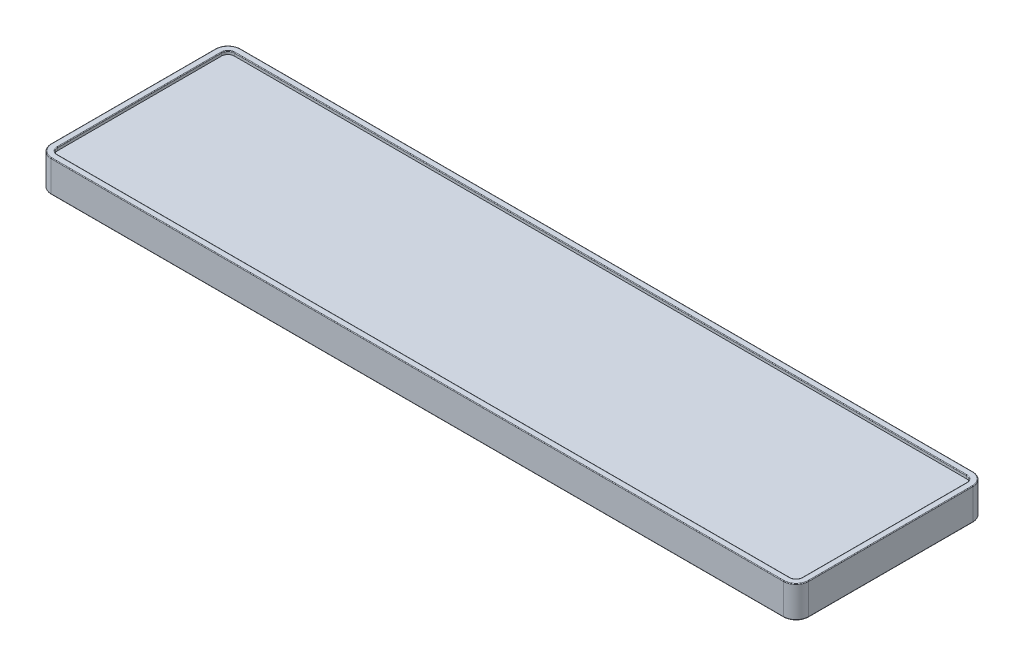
SolidWorks part; units mm, degrees
ref_plane "Alzado" through (0, 0, 0) normal (0, 0, 1) x (1, 0, 0)
ref_plane "Planta" through (0, 0, 0) normal (0, 1, 0) x (1, 0, 0)
ref_plane "Vista lateral" through (0, 0, 0) normal (1, 0, 0) x (0, 0, -1)
sketch "Croquis1" plane through (0, 0, 0) normal (0, 1, 0) x (1, 0, 0)
  line L1 (-580, -150) -> (580, -150)
  line L2 (-600, -130) -> (-600, 130)
  line L3 (-580, 150) -> (580, 150)
  line L4 (600, -130) -> (600, 130)
  line L5 (-600, -150) -> (600, 150) construction
  line L6 (-600, 150) -> (600, -150) construction
  arc A0 (-580, -150) -> (-600, -130) centre (-580, -130) cw
  arc A1 (580, -150) -> (600, -130) centre (580, -130) ccw
  arc A2 (580, 150) -> (600, 130) centre (580, 130) cw
  arc A3 (-600, 130) -> (-580, 150) centre (-580, 130) cw
  point P0 (0, 0)
  dimension "D3" = 20
  dimension "D1" = 300
  dimension "D2" = 1200
extrude "Saliente-Extruir1" add sketch "Croquis1" along normal blind 50
sketch "Croquis2" plane through (0, 50, 0) normal (0, 1, 0) x (1, 0, 0)
  line L8 (-580, -140) -> (580, -140)
  line L9 (590, -130) -> (590, 130)
  line L10 (580, 140) -> (-580, 140)
  line L11 (-590, 130) -> (-590, -130)
  line L12 (-580, -140) -> (580, -140)
  line L13 (590, -130) -> (590, 130)
  line L14 (580, 140) -> (-580, 140)
  line L15 (-590, 130) -> (-590, -130)
  arc A8 (-590, -130) -> (-580, -140) centre (-580, -130) ccw
  arc A9 (580, -140) -> (590, -130) centre (580, -130) ccw
  arc A10 (590, 130) -> (580, 140) centre (580, 130) ccw
  arc A11 (-580, 140) -> (-590, 130) centre (-580, 130) ccw
  arc A12 (-590, -130) -> (-580, -140) centre (-580, -130) ccw
  arc A13 (580, -140) -> (590, -130) centre (580, -130) ccw
  arc A14 (590, 130) -> (580, 140) centre (580, 130) ccw
  arc A15 (-580, 140) -> (-590, 130) centre (-580, 130) ccw
  dimension "D1" = 10
extrude "Cortar-Extruir1" cut sketch "Croquis2" against normal blind 5
shell "Vaciado1" thickness 10
fillet "Redondeo1" radius 1 16 edges at (-600, 50, 0) (-594.1421, 50, -144.1421) (0, 50, -150) (594.1421, 50, -144.1421) (600, 50, 0) (594.1421, 50, 144.1421) (0, 50, 150) (-594.1421, 50, 144.1421) (587.0711, 50, 137.0711) (590, 50, 0) (587.0711, 50, -137.0711) (0, 50, -140) (-587.0711, 50, -137.0711) (-590, 50, 0) (-587.0711, 50, 137.0711) (0, 50, 140)
fillet "Redondeo2" radius 1 16 edges at (-587.0711, 0, -137.0711) (0, 0, -140) (587.0711, 0, -137.0711) (590, 0, 0) (587.0711, 0, 137.0711) (0, 0, 140) (-587.0711, 0, 137.0711) (-590, 0, 0) (0, 0, 150) (594.1421, 0, 144.1421) (600, 0, 0) (594.1421, 0, -144.1421) (0, 0, -150) (-594.1421, 0, -144.1421) (-600, 0, 0) (-594.1421, 0, 144.1421)
